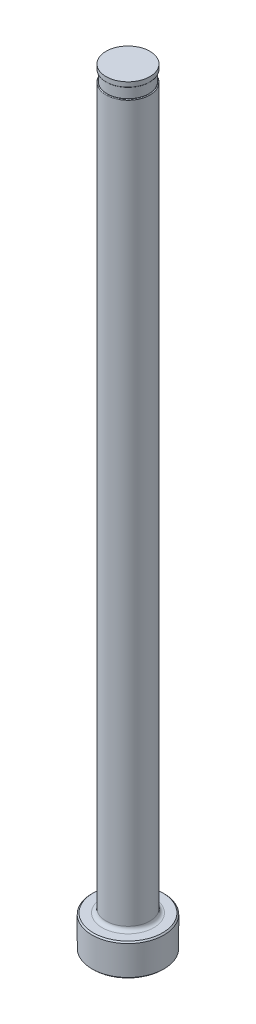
SolidWorks part; units mm, degrees
ref_plane "Front Plane" through (0, 0, 0) normal (0, 0, 1) x (1, 0, 0)
ref_plane "Top Plane" through (0, 0, 0) normal (0, 1, 0) x (1, 0, 0)
ref_plane "Right Plane" through (0, 0, 0) normal (1, 0, 0) x (0, 0, -1)
other "Configuration Table"
sketch "Sketch1" plane through (0, 0, 0) normal (0, 0, 1) x (1, 0, 0)
  line L0 (0, 259.9588) -> (0, -15.1925) construction
  line L1 (0, 0) -> (-7.1374, 0)
  line L2 (-7.1374, 0) -> (-7.1374, 6.35)
  line L3 (-7.1374, 6.35) -> (-4.365, 6.35)
  line L4 (-4.365, 6.35) -> (-4.365, 152.4)
  line L5 (-4.365, 152.4) -> (0, 152.4)
  line L6 (0, 152.4) -> (0, 0)
  dimension "L" = 152.4
  dimension "H" = 14.2748
  dimension "T" = 6.35
  dimension "D" = 8.73
revolve "Revolve1" add sketch "Sketch1" angle 360 about L0
chamfer "Chamfer1" distance 0.254 angle 45 2 edges at (0, 6.35, 7.1374) (0, 0, 7.1374)
fillet "Fillet1" radius 0.762 1 edges at (0, 6.35, 4.365)
sketch "Sketch2" plane through (0, 0, 0) normal (0, 0, 1) x (1, 0, 0)
  line L0 (-4.365, 152.4) -> (-4.365, 7.112) construction
  line L1 (-4.365, 151.384) -> (-4.1618, 151.384)
  line L2 (-4.365, 151.384) -> (-4.365, 149.352)
  line L3 (-4.365, 149.352) -> (-4.1618, 149.352)
  line L4 (-4.1618, 151.384) -> (-4.1618, 149.352)
  line L5 (4.365, 152.4) -> (-4.365, 152.4) construction
  line L6 (0, 153.4483) -> (0, 147.3282) construction
  dimension "D1" = 2.032
  dimension "N" = 1.016
  dimension "FD" = 0.2032
  dimension "D3" = 8.3236
revolve "Vent Relief" cut sketch "Sketch2" angle 360 about L6
sketch "Sketch3" plane through (0, 0, 0) normal (0, 0, 1) x (1, 0, 0)
  line L0 (-4.1618, 150.368) -> (-4.1618, 86.868)
  line L1 (-4.1618, 151.384) -> (-4.1618, 149.352) construction
  line L2 (-4.365, 149.352) -> (-4.365, 7.112) construction
  line L3 (-4.365, 85.7504) -> (-4.365, 150.368)
  line L4 (-4.365, 150.368) -> (-4.1618, 150.368)
  arc A0 (-4.1618, 86.868) -> (-4.365, 85.7504) centre (-7.3368, 86.868) cw
  dimension "D1" = 3.175
  dimension "D2" = 63.5
extrude "D-Slot" cut sketch "Sketch3" against normal through all both and the other way through all
sketch "Sketch5" plane through (0, 0, 0) normal (0, 0, 1) x (1, 0, 0)
  line L0 (-4.365, 151.384) -> (4.365, 151.384) construction
  line L1 (-4.365, 152.4) -> (-4.3599, 152.4)
  line L2 (-4.365, 152.4) -> (-4.365, 151.384)
  line L3 (-4.365, 151.384) -> (-4.3599, 151.384)
  line L4 (-4.3599, 152.4) -> (-4.3599, 151.384)
  line L5 (0, 152.6877) -> (0, 150.5771) construction
  dimension "VP" = 0.0051
revolve "Vent Diameter" cut sketch "Sketch5" angle 360 about L5
fillet "Fillet2" radius 0.127 2 edges at (4.365, 149.352, 0) (0, 151.384, 4.3599)
sketch "Pocket Sketch" plane through (0, 0, 0) normal (0, 0, 1) x (1, 0, 0)
  line L0 (-7.5343, 0) -> (-7.5343, 6.3754)
  line L1 (-7.5343, 6.3754) -> (-5.3254, 6.3754)
  line L2 (-4.5634, 7.1374) -> (-4.5634, 22.225)
  line L3 (-4.5634, 22.225) -> (0, 22.225)
  line L4 (0, 22.225) -> (0, 0)
  line L5 (0, 0) -> (-7.5343, 0)
  line L6 (0, 12.6104) -> (0, -2.4989) construction
  line L7 (-7.1374, 6.096) -> (-7.1374, 0.254) construction
  line L8 (6.8834, 6.35) -> (-6.8834, 6.35) construction
  line L9 (-4.365, 85.7504) -> (-4.365, 7.112) construction
  line L10 (-5.3254, 6.3754) -> (-4.5634, 7.1374)
  point P3 (-4.5634, 6.3754)
  dimension "D1" = 15.0685
  dimension "D2" = 0.3969
  dimension "D3" = 0.0254
  dimension "D4" = 0.1984
  dimension "D5" = 9.1269
  dimension "D6" = 22.225
